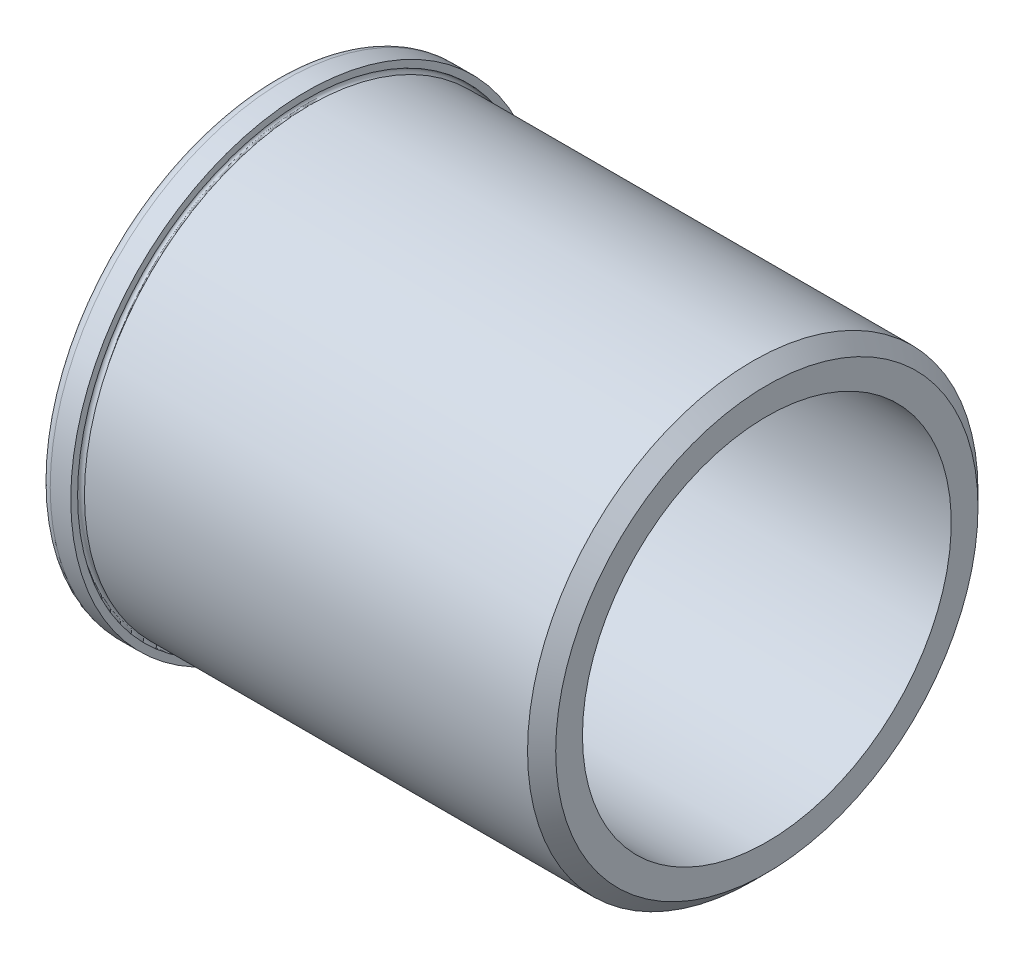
SolidWorks part; units mm, degrees
ref_plane "Plane1" through (0, 0, 0) normal (0, 0, 1) x (1, 0, 0)
ref_plane "Plane2" through (0, 0, 0) normal (0, 1, 0) x (1, 0, 0)
ref_plane "Plane3" through (0, 0, 0) normal (1, 0, 0) x (0, 0, -1)
sketch "Sketch1" plane through (0, 0, 0) normal (0, 0, 1) x (1, 0, 0)
  line L0 (0, 0) -> (76.2, 0) construction
  line L1 (0, 31.7691) -> (0, 34.925)
  line L2 (1.5875, 36.5125) -> (4.7752, 36.5125)
  line L3 (4.7752, 36.5125) -> (4.7752, 35.4542)
  line L4 (5.3044, 34.925) -> (74.0172, 34.925)
  line L5 (74.0172, 34.925) -> (76.2, 32.7422)
  line L6 (76.2, 32.7422) -> (76.2, 28.594)
  line L7 (76.2, 28.594) -> (3.175, 28.5941)
  line L8 (74.0172, -34.925) -> (76.2, -32.7422) construction
  line L9 (76.2, -28.594) -> (0, -28.5941) construction
  line L10 (5.3044, -34.925) -> (74.0172, -34.925) construction
  line L11 (0, -36.5125) -> (4.7752, -36.5125) construction
  arc A0 (4.7752, 35.4542) -> (5.3044, 34.925) centre (4.7752, 34.925) ccw
  arc A1 (0, 31.7691) -> (3.175, 28.5941) centre (3.175, 31.7691) ccw
  arc A2 (1.5875, 36.5125) -> (0, 34.925) centre (1.5875, 34.925) ccw
  point P20 (0, 28.5941)
  point P23 (0, 36.5125)
  dimension "Head_radius" = 3.175
  dimension "D1" = 0.5292
  dimension "D4" = 1.5875
  dimension "Hole_dia" = 57.1881
  dimension "Body_dia" = 69.85
  dimension "Head_dia" = 73.025
  dimension "Head_thickness" = 4.7752
  dimension "D2" = 65.4844
  dimension "D3" = 45
  dimension "Body_len" = 76.2
revolve "BaseBody" add sketch "Sketch1" angle 360 about L0
equation "\"D2@Sketch1\" = \"Body_dia@Sketch1\" * .9375"
equation "\"D4@Sketch1\" = \"Head_radius@Sketch1\" / 2"
equation "\"D1@Sketch1\" =  (  ( \"Head_dia@Sketch1\" - \"Body_dia@Sketch1\" )  / 2 )  / 3"
